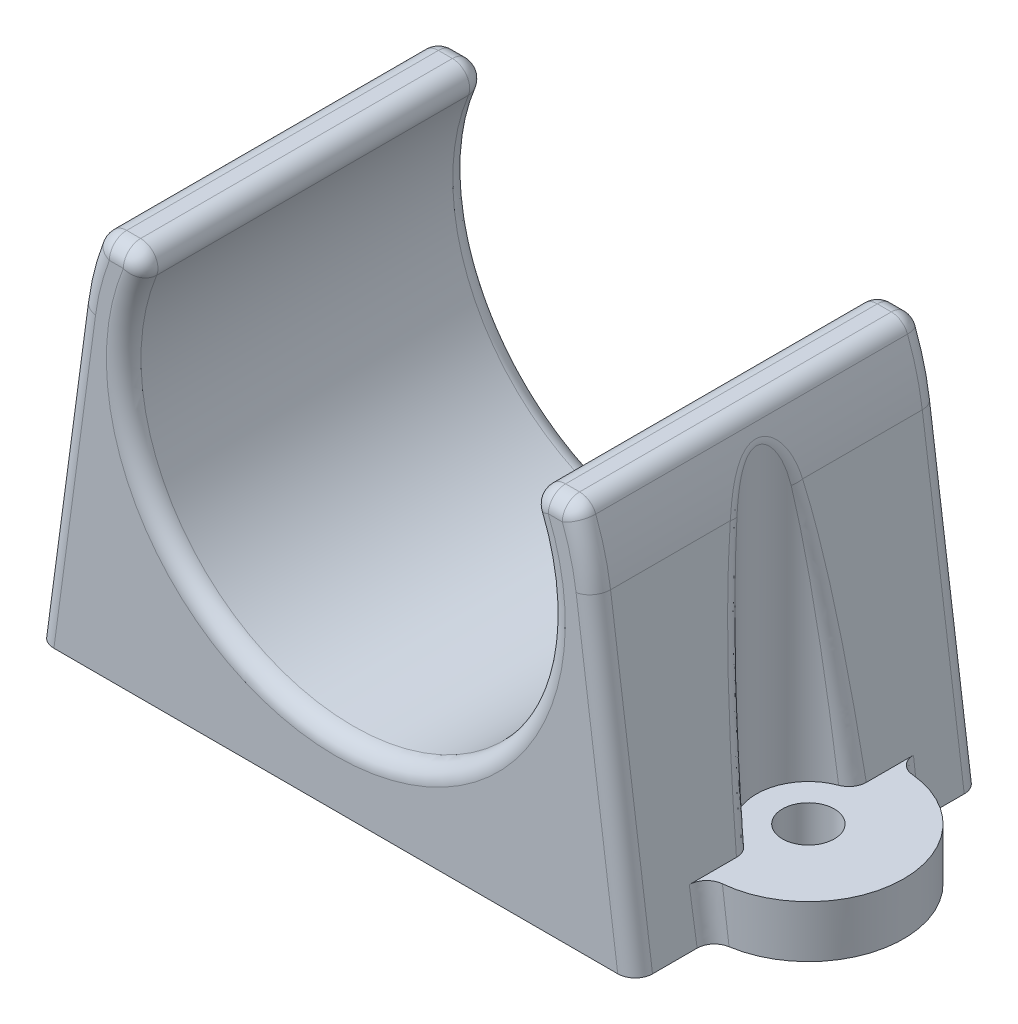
SolidWorks part; units mm, degrees
ref_plane "Front Plane" through (0, 0, 0) normal (0, 0, 1) x (1, 0, 0)
ref_plane "Top Plane" through (0, 0, 0) normal (0, 1, 0) x (1, 0, 0)
ref_plane "Right Plane" through (0, 0, 0) normal (1, 0, 0) x (0, 0, -1)
sketch "Sketch2" plane through (0, 0, 0) normal (0, 0, 1) x (1, 0, 0)
  line L1 (-15, -16) -> (15, -16)
  line L2 (-15, -16) -> (-15, 16)
  line L3 (-15, 16) -> (15, 16)
  line L4 (15, -16) -> (15, 16)
  line L5 (-15, -16) -> (15, 16) construction
  line L6 (-15, 16) -> (15, -16) construction
  circle A0 centre (0, 0) radius 12.25
  circle A1 centre (0, 0) radius 15
  point P0 (0, 0)
  dimension "D1" = 24.5
  dimension "D2" = 15
  dimension "D3" = 16
extrude "Boss-Extrude1" add sketch "Sketch2" along normal mid plane 20 contours A1 A0 | A1 L2 L1 L4
sketch "Sketch3" plane through (0, 0, 0) normal (0, 0, 1) x (1, 0, 0)
  line L1 (-18.8696, 6) -> (18.8696, 6)
  line L2 (-18.8696, 6) -> (-18.8696, 18.88)
  line L3 (-18.8696, 18.88) -> (18.8696, 18.88)
  line L4 (18.8696, 6) -> (18.8696, 18.88)
  line L5 (-18.8696, 6) -> (18.8696, 18.88) construction
  line L6 (-18.8696, 18.88) -> (18.8696, 6) construction
  point P0 (0, 12.44)
  dimension "D1" = 6
extrude "Cut-Extrude1" cut sketch "Sketch3" against normal through all both and the other way through all
sketch "Sketch5" plane through (0, 0, 0) normal (0, 0, 1) x (1, 0, 0)
  line L0 (-14.8661, 2) -> (-17.2877, -16)
  line L1 (-17.2877, -16) -> (-14.8661, -16)
  line L2 (-14.8661, -16) -> (-14.8661, 2)
  line L6 (-15, -16) -> (15, -16) construction
  arc A3 (-13.7477, 6) -> (-15, 0) centre (0, 0) ccw construction
  point P3 (-14.7853, 2.529)
  point P9 (-14.5388, 3.6911)
  point P10 (-15, 0)
  point P11 (-14.4556, 4.0044)
  point P12 (-14.7147, 2.9114)
  point P13 (-14.6175, -15)
  dimension "D1" = 18
extrude "Boss-Extrude2" add sketch "Sketch5" along normal mid plane 20
mirror "Mirror1" about plane through (0, 0, 0) normal (1, 0, 0) of "Boss-Extrude2"
sketch "Sketch4" plane through (0, -16, 0) normal (0, -1, 0) x (1, 0, 0)
  line L0 (-17.2877, 0) -> (17.2877, 0) construction
  line L1 (-17.2877, 5.5) -> (17.2877, 5.5)
  line L2 (-17.2877, -5.5) -> (17.2877, -5.5)
  line L4 (-17.2877, 10) -> (-17.2877, -10) construction
  arc A0 (-17.2877, 5.5) -> (-17.2877, -5.5) centre (-17.2877, 0) ccw
  arc A1 (17.2877, -5.5) -> (17.2877, 5.5) centre (17.2877, 0) ccw
  circle A2 centre (-17.2877, 0) radius 1.5
  circle A3 centre (17.2877, 0) radius 1.5
  point P2 (0, 0)
  point P8 (-18.3712, 3.9813)
  point P14 (-20.4175, 7.5)
  point P15 (-20.7543, 7.5)
  point P17 (18.3712, -4.6782)
  dimension "D1" = 3
  dimension "D2" = 5.5
extrude "Boss-Extrude3" add sketch "Sketch4" against normal blind 3
sketch "Sketch6" plane through (0, -16, 0) normal (0, -1, 0) x (1, 0, 0)
  line L0 (-17.2877, 1.5) -> (-17.2877, -1.5) construction
  line L1 (17.2877, 1.5) -> (17.2877, -1.5) construction
  circle A0 centre (-17.2877, 0) radius 1.5
  circle A1 centre (17.2877, 0) radius 1.5
extrude "Cut-Extrude2" cut sketch "Sketch6" against normal through all
sketch "Sketch7" plane through (0, -13, 0) normal (0, 1, 0) x (1, 0, 0)
  circle A0 centre (-17.2877, 0) radius 3
  circle A1 centre (17.2877, 0) radius 3
  dimension "D1" = 6
  dimension "D2" = 6
extrude "Cut-Extrude3" cut sketch "Sketch7" along normal through all
fillet "Fillet1" radius 1 4 edges at (13.7477, 6, 0) (-13.7477, 6, 0) (-10.68, 6, 0) (10.68, 6, 0)
fillet "Fillet2" radius 1 22 edges at (-16.0769, -7, -10) (-16.0769, -7, 10) (-14.5357, 3.7033, -10) (-13.6436, 5.8238, -10) (-12.6735, 6, -10) (-11.4405, 5.558, -10) (16.0769, -7, -10) (16.0769, -7, 10) (14.5357, 3.7033, -10) (13.6436, 5.8238, -10) (12.6735, 6, -10) (11.4405, 5.558, -10) (-14.5357, 3.7033, 10) (-13.6436, 5.8238, 10) (-12.6735, 6, 10) (-11.4405, 5.558, 10) (14.5357, 3.7033, 10) (13.6436, 5.8238, 10) (12.6735, 6, 10) (11.4405, 5.558, 10) (0, -12.25, -10) (0, -12.25, 10)
fillet "Fillet3" radius 1 10 edges at (15.7526, -4.5893, -2.5775) (15.7526, -4.5893, 2.5775) (14.2889, 4.5639, -0.0834) (-15.7526, -4.5893, 2.5775) (-15.7526, -4.5893, -2.5775) (-14.2889, 4.5639, 0.0834) (-17.0859, -14.5, 5.5) (-17.0859, -14.5, -5.5) (17.0859, -14.5, -5.5) (17.0859, -14.5, 5.5)
